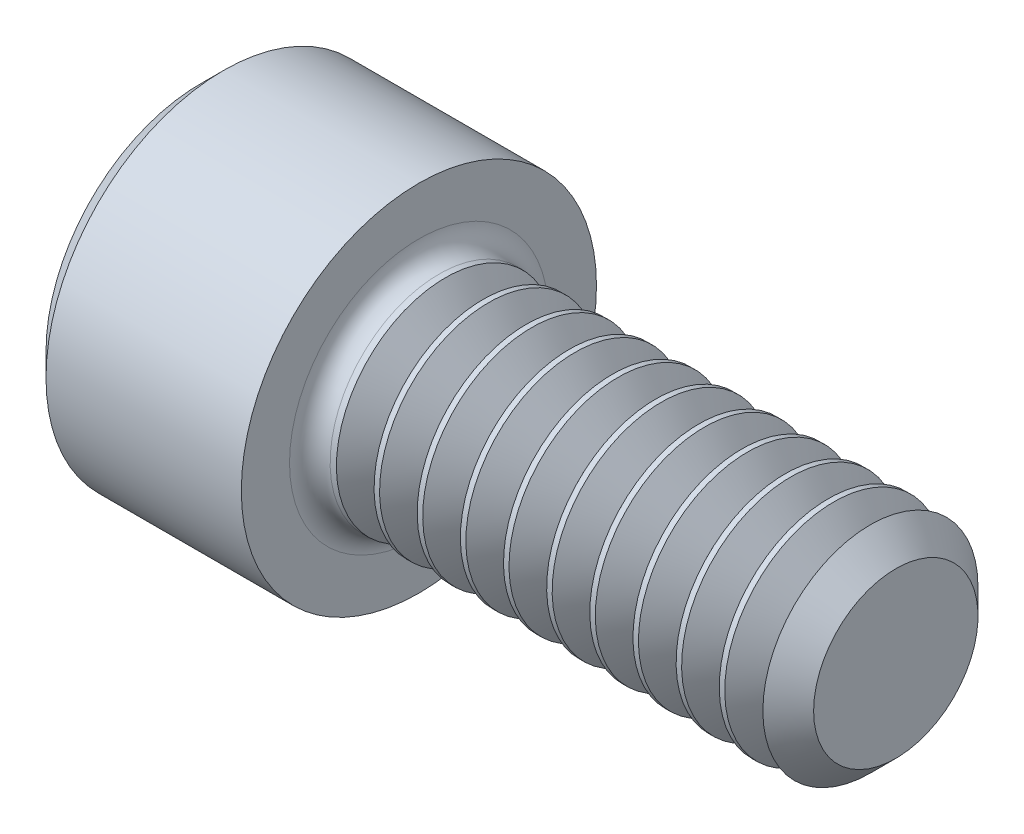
SolidWorks part; units mm, degrees
ref_plane "Plane1" through (0, 0, 0) normal (0, 0, 1) x (1, 0, 0)
ref_plane "Plane2" through (0, 0, 0) normal (0, 1, 0) x (1, 0, 0)
ref_plane "Plane3" through (0, 0, 0) normal (1, 0, 0) x (0, 0, -1)
sketch "BodySke" plane through (0, 0, 0) normal (0, 0, 1) x (1, 0, 0)
  line L0 (0, 0) -> (0, 1.5494)
  line L1 (0.2286, 1.778) -> (2.1844, 1.778)
  line L2 (2.1844, 1.778) -> (2.1844, 1.0922)
  line L3 (2.1844, 1.0922) -> (6.6904, 1.0922)
  line L4 (6.9596, 0.823) -> (6.9596, 0)
  line L5 (6.9596, 0) -> (0, 0)
  line L6 (-31.75, 0) -> (127, 0) construction
  line L7 (0, 1.5494) -> (0.2286, 1.778)
  line L8 (6.9596, 0.823) -> (6.6904, 1.0922)
  line L9 (0, -1.5494) -> (0.2286, -1.778) construction
  line L10 (6.9596, -0.823) -> (6.6904, -1.0922) construction
  line L11 (2.6391, 9.525) -> (2.6391, 3.175) construction
  line L12 (2.1844, 9.525) -> (2.1844, 3.175) construction
  line L13 (-31.1404, 9.525) -> (-31.1404, 3.175) construction
  dimension "Diameter" = 2.1844
  dimension "Head_ht" = 2.1844
  dimension "Length" = 4.7752
  dimension "Body_ch_ang" = 45
  dimension "Head_dia" = 3.556
  dimension "Head_ch_ang" = 45
  dimension "Head_side_ht" = 1.9558
  dimension "Minor_dia" = 1.6459
  dimension "Advance" = 0.4547
  dimension "Thread_nom" = 4.7752
  dimension "Thread_length" = 38.1
revolve "Base-Revolve" add sketch "BodySke"
fillet "Fillet1" radius 0.2032 1 edges at (2.1844, 0, 1.0922)
sketch "Sketch2" plane through (0, 0, 0) normal (0, 0, 1) x (1, 0, 0)
  line L0 (0, 0.9906) -> (0.9652, 0.9906)
  line L1 (0.9652, 0.9906) -> (1.5371, 0)
  line L2 (-31.75, 0) -> (127, 0) construction
  line L3 (1.5371, 0) -> (0, 0)
  line L4 (0, 0) -> (0, 0.9906)
  line L5 (0, 1.5494) -> (0, -1.5494) construction
  line L6 (0, 0) -> (47.625, 0) construction
  line L7 (2.1844, -1.778) -> (2.1844, 1.778) construction
  dimension "D1" = 0.9906
  dimension "D2" = 60
  dimension "Wall_thickness" = 1.2192
revolve "Hex-PreBroach" cut sketch "Sketch2" angle 360 about L6
sketch "Sketch3" plane through (0, 0, 0) normal (-1, 0, 0) x (0, 0.5, 0.866)
  line L0 (0.5719, 0.9906) -> (-0.5719, 0.9906)
  line L1 (-0.5719, 0.9906) -> (-1.1438, 0)
  line L2 (0.5719, 0.9906) -> (1.1438, 0)
  line L3 (0.5719, -0.9906) -> (1.1438, 0)
  line L4 (0.5719, -0.9906) -> (-0.5719, -0.9906)
  line L5 (-0.5719, -0.9906) -> (-1.1438, 0)
  dimension "D1" = 0.9906
  dimension "D2" = 0.9906
  dimension "Hex_size" = 1.9812
extrude "Hex" cut sketch "Sketch3" against normal blind 0.9652
sketch "Sketch4" plane through (0, 0, 0) normal (-1, 0, 0) x (0, 0, 1)
  line L0 (0, 0) -> (1.2446, 0)
  line L1 (0, 0) -> (6.1484, 3.5498) construction
  line L2 (0, 0) -> (0.6223, 1.0779)
  line L3 (1.0085, 0.2596) -> (1.19, 0.3644)
  line L4 (0.7291, 0.7436) -> (0.9106, 0.8484)
  arc A0 (1.0085, 0.2596) -> (0.7291, 0.7436) centre (0, 0) ccw
  arc A1 (1.2446, 0) -> (1.19, 0.3644) centre (0, 0) ccw
  arc A2 (0.6223, 1.0779) -> (0.9106, 0.8484) centre (0, 0) cw
  dimension "D1" = 30
  dimension "Spline_n_dim" = 2.0828
  dimension "Spline_m_dim" = 2.4892
  dimension "D2" = 60
  dimension "D3" = 0.2794
  dimension "Spline_p_dim" = 0.5588
extrude "Spline" [suppressed] cut sketch "Sketch4" against normal blind 0.9652
pattern_circular "CirPattern1" [suppressed] count 6 every 60
sketch "Sketch5" plane through (0, 0, 0) normal (0, 0, 1) x (1, 0, 0)
  line L0 (-31.75, 0) -> (127, 0) construction
  line L2 (0, 1.5494) -> (0, -1.5494) construction
  circle A0 centre (0.254, 0) radius 0.0127
  dimension "Drilled_hole_dia" = 0.0254
  dimension "Drilled_hole_loc" = 0.254
extrude "Hole" [suppressed] cut sketch "Sketch5" against normal through all and the other way through all
pattern_circular "Drilled-4" [suppressed] count 2 every 60
pattern_circular "Drilled-6" [suppressed] count 3 every 60
sketch "ThdSchSke" plane through (0, 0, 0) normal (0, 0, 1) x (1, 0, 0)
  line L0 (2.6391, -0.823) -> (2.4505, -1.0922)
  line L1 (2.6391, -0.823) -> (2.8276, -1.0922)
  line L2 (2.8276, -1.0922) -> (2.8276, -1.3653)
  line L3 (-3.175, 0) -> (5.1513, 0) construction
  line L5 (2.8276, -1.3653) -> (2.4505, -1.3653)
  line L6 (2.4505, -1.3653) -> (2.4505, -1.0922)
  line L7 (0, 1.5494) -> (0, -1.5494) construction
  dimension "Thread_minor" = 1.6459
  dimension "Diameter" = 2.1844
  dimension "Start" = 2.6391
  dimension "SideAngle" = 55
  dimension "VeeAngle" = 70
  dimension "Overcut" = 2.7305
revolve "ThreadSchematic" cut sketch "ThdSchSke" angle 360 about L3
pattern_linear "ThdSchPat" count 10 spacing 0.4321 along (1, 0, 0) of "ThreadSchematic"
equation "\"D2@Sketch3\" = \"Hex_size@Sketch3\" / 2"
equation "\"D1@Sketch3\" = \"Hex_size@Sketch3\" / 2"
equation "\"D1@Sketch2\" = \"Hex_size@Sketch3\" / 2"
equation "\"D3@Sketch4\" = \"Spline_p_dim@Sketch4\" / 2"
equation "\"Thread_minor@ThreadCosmetic\"  =  \"Minor_dia@BodySke\""
equation "\"D2@CirPattern1\" = 360 / \"Num_teeth@CirPattern1\""
equation "\"Wall_thickness@Sketch2\" = \"Head_ht@BodySke\" - \"Key_eng@Hex\""
equation "\"Thread_length@ThreadCosmetic\" = ((sgn( (\"Length@BodySke\" - \"Advance@BodySke\" ) - \"Thread_nom@BodySke\" )-1)*( (\"Length@BodySke\" - \"Advance@BodySke\" ) - \"Thread_nom@BodySke\" ))/-2+ \"Thread_nom@BodySke\""
equation "\"Thread_minor@ThdSchSke\" = \"Minor_dia@BodySke\""
equation "\"Diameter@ThdSchSke\" = \"Diameter@BodySke\""
equation "\"Overcut@ThdSchSke\" = \"Diameter@BodySke\" * 1.25"
equation "\"Start@ThdSchSke\" = \"Head_ht@BodySke\" + \"Length@BodySke\" - \"Thread_length@ThreadCosmetic\"  '---Non-countersunk---"
equation "\"Num_threads@ThdSchPat\" = int( \"Thread_length@ThreadCosmetic\" / \"Advance@BodySke\" + 0.999 )  + 1"
equation "\"Advance@ThdSchPat\" = \"Thread_length@ThreadCosmetic\" /  (\"Num_threads@ThdSchPat\" - 1) 'relax it"
equation "\"Num_threads@ThdSchPat\" = \"Num_threads@ThdSchPat\" - sgn( \"Num_threads@ThdSchPat\" - 1) '---chamfered tips only---"
